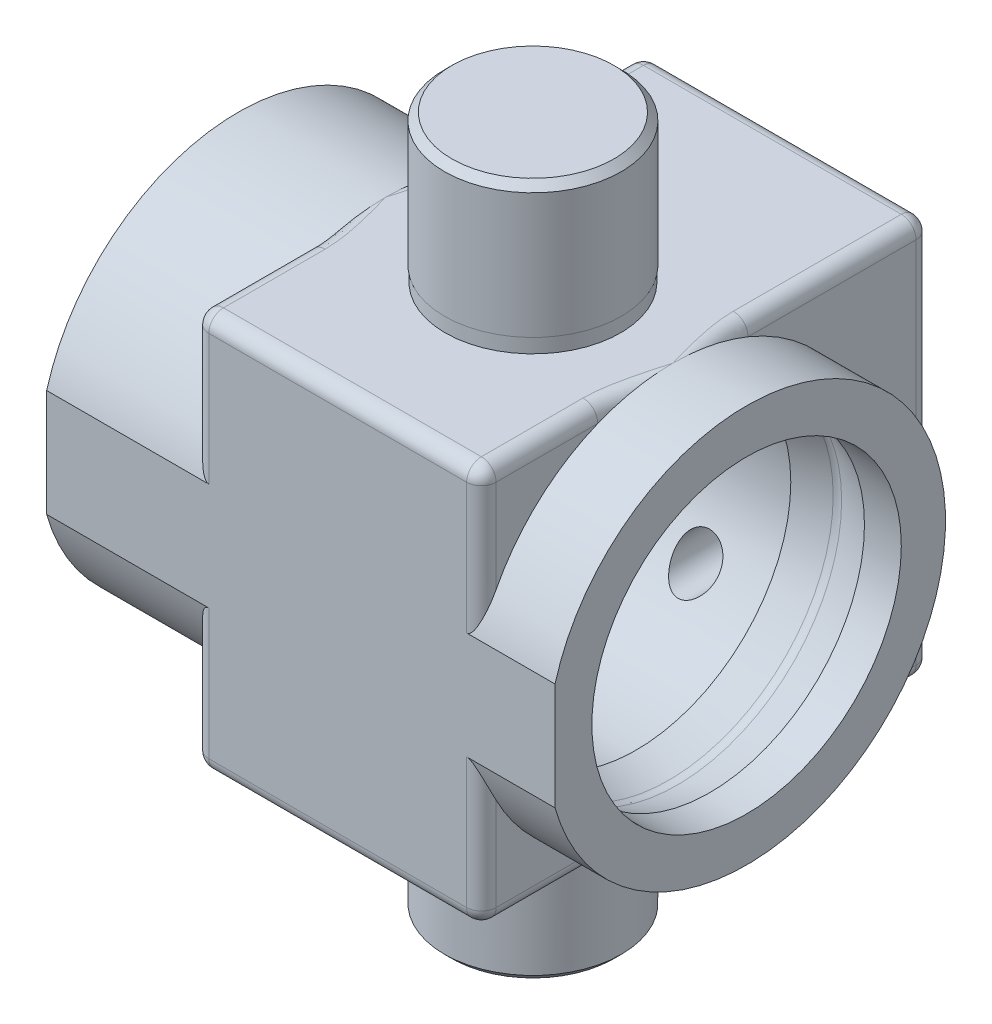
SolidWorks part; units mm, degrees
ref_plane "Plan1" through (0, 0, 0) normal (0, 0, 1) x (1, 0, 0)
ref_plane "Plan2" through (0, 0, 0) normal (0, 1, 0) x (1, 0, 0)
ref_plane "Plan3" through (0, 0, 0) normal (1, 0, 0) x (0, 0, -1)
sketch "Esquisse1" plane through (0, 0, 0) normal (0, 0, 1) x (1, 0, 0)
  line L1 (-40, -40) -> (29, -40)
  line L2 (-40, -40) -> (-40, 14)
  line L3 (-40, 14) -> (29, 14)
  line L4 (29, -40) -> (29, 14)
  dimension "D1" = 69
  dimension "D2" = 54
extrude "Base-Extrusion" add sketch "Esquisse1" along normal blind 61
sketch "Esquisse2" plane through (29, 0, 0) normal (1, 0, 0) x (0, 0, -1)
  line L0 (-35, 20) -> (-35, -50) construction
  line L1 (-61, -40) -> (-61, 14) construction
  line L2 (-70, -13) -> (10, -13) construction
  line L3 (-61, -40) -> (0, -40) construction
  circle A0 centre (-35, -13) radius 21
  dimension "D3" = 42
  dimension "D1" = 26
  dimension "D2" = 27
extrude "Enlèv. mat.-Extru.1" cut sketch "Esquisse2" against normal through all
ref_plane "Plan4" through (0, 0, 35) normal (0, 0, 1) x (1, 0, 0)
sketch "Esquisse6" plane through (0, 0, 35) normal (0, 0, 1) x (1, 0, 0)
  line L0 (65.5546, -13) -> (-67.3117, -13) construction
  line L1 (-40, -13) -> (29, -13) construction
  line L2 (-35, -13) -> (-25, -13)
  line L3 (-35, 8) -> (-35, -13)
  line L4 (14, -13) -> (24, -13)
  line L5 (-40, 14) -> (-40, -40) construction
  line L6 (-25, 8) -> (-25, -13)
  line L7 (24, 8) -> (24, -13)
  line L8 (29, -40) -> (29, 14) construction
  line L9 (14, 8) -> (14, -13)
  line L11 (-35, 8) -> (-30.6099, 9.2907)
  line L12 (-29.4923, 9.2938) -> (-25, 8)
  line L13 (14, 8) -> (18.4253, 9.3276)
  line L14 (19.5747, 9.3276) -> (24, 8)
  arc A0 (-29.4923, 9.2938) -> (-30.6099, 9.2907) centre (-30.0458, 7.3719) ccw
  arc A1 (19.5747, 9.3276) -> (18.4253, 9.3276) centre (19, 7.4119) ccw
  dimension "D1" = 2
  dimension "D2" = 5
  dimension "D3" = 10
  dimension "D4" = 5
  dimension "D5" = 10
revolve "Enlèvement de matière-Révolution1" cut sketch "Esquisse6" angle 360 about L0
sketch "Esquisse8" plane through (0, 0, 0) normal (1, 0, 0) x (0, 0, -1)
  line L0 (-35, 34) -> (-35, -60) construction
  line L1 (-47, 16) -> (-47, 34)
  line L2 (-61, 14) -> (0, 14) construction
  line L3 (-47, 34) -> (-35, 34)
  line L4 (-35, 14) -> (-35, 34)
  line L7 (-46.9, 16) -> (-46.9, 14)
  line L9 (-47, 16) -> (-46.9, 16)
  line L11 (-46.9, 14) -> (-35, 14)
  dimension "D3" = 12
  dimension "D4" = 11.9
  dimension "D5" = 2
revolve "Boss.-Révol.3" add sketch "Esquisse8" angle 360 about L0
sketch "Esquisse9" plane through (0, 0, 35) normal (0, 0, 1) x (1, 0, 0)
  line L0 (-11.9, -40) -> (-11.9, -42)
  line L1 (-40, -40) -> (29, -40) construction
  line L2 (-12, -42) -> (-11.9, -42)
  line L3 (0, 34) -> (0, -60) construction
  line L4 (-12, -42) -> (-12, -60)
  line L5 (-12, -60) -> (0, -60)
  line L6 (0, -29.72) -> (0, -73.63) construction
  line L7 (-11.9, -40) -> (0, -40)
  line L8 (0, -60) -> (0, -40)
  dimension "D1" = 11.9
  dimension "D2" = 2
  dimension "D3" = 12
  dimension "D4" = 20
revolve "Boss.-Révol.4" add sketch "Esquisse9" angle 360 about L6
sketch "Esquisse10" plane through (0, 0, 0) normal (0, 0, -1) x (-1, 0, 0)
  line L0 (-5, 28.59) -> (-5, -55.75) construction
  line L1 (-29, -40) -> (-29, 14) construction
  line L2 (-12.64, -1) -> (3.54, -1) construction
  line L3 (-11.25, -25) -> (0, -25) construction
  line L4 (25, -13) -> (-14, -13) construction
  circle A0 centre (-5, -1) radius 3
  circle A1 centre (-5, -25) radius 3
  dimension "D4" = 6
  dimension "D5" = 6
  dimension "D1" = 24
  dimension "D2" = 12
  dimension "D3" = 12
extrude "Enlèv. mat.-Extru.2" cut sketch "Esquisse10" against normal blind 22
chamfer "Chanfrein2" distance 1 angle 45 2 edges at (0, 34, 47) (0, -60, 47)
chamfer "Chanfrein3" distance 0.8 angle 45 2 edges at (2, -1, 0) (2, -25, 0)
sketch "Esquisse11" plane through (-40, 0, 0) normal (-1, 0, 0) x (0, 0, 1)
  line L1 (0, -40) -> (35, -40)
  line L2 (0, 14) -> (35, 14)
  line L3 (0, 14) -> (0, -40)
  line L4 (0, 14) -> (0, -40) construction
  line L5 (61, 14) -> (0, 14) construction
  line L6 (61, -40) -> (0, -40) construction
  arc A0 (35, 14) -> (35, -40) centre (35, -13) ccw
  circle A2 centre (35, -13) radius 22.2907 construction
extrude "Enlèv. mat.-Extru.3" cut sketch "Esquisse11" against normal blind 20
sketch "Esquisse12" plane through (-40, 0, 0) normal (-1, 0, 0) x (0, 0, 1)
  line L0 (35, 14) -> (61, 14)
  line L1 (35, -40) -> (61, -40)
  line L2 (61, 14) -> (61, -5.7199)
  line L3 (35, 14) -> (0, 14) construction
  line L4 (61, 14) -> (61, -40) construction
  line L5 (61, -40) -> (35, -40) construction
  line L6 (61, -20.2801) -> (61, -40)
  arc A0 (35, -40) -> (61, -20.2801) centre (35, -13) ccw
  arc A1 (35, 14) -> (35, -40) centre (35, -13) ccw construction
  arc A2 (61, -5.7199) -> (35, 14) centre (35, -13) ccw
extrude "Enlèv. mat.-Extru.4" cut sketch "Esquisse12" against normal blind 20
sketch "Esquisse13" plane through (29, 0, 0) normal (1, 0, 0) x (0, 0, -1)
  line L0 (-35, 14) -> (0, 14)
  line L1 (0, 14) -> (0, -40)
  line L2 (0, -40) -> (-35, -40)
  arc A0 (-35, -40) -> (-35, 14) centre (-35, -13) ccw
  arc A1 (-35, 14) -> (-61, -5.7199) centre (-35, -13) ccw construction
extrude "Enlèv. mat.-Extru.5" cut sketch "Esquisse13" against normal blind 10
sketch "Esquisse14" plane through (29, 0, 0) normal (1, 0, 0) x (0, 0, -1)
  line L0 (-35, 14) -> (-61, 14)
  line L1 (-61, 14) -> (-61, -5.7199)
  line L2 (-61, -40) -> (-35, -40)
  line L5 (-61, -40) -> (-61, 14) construction
  line L6 (-61, -40) -> (-35, -40) construction
  line L7 (-61, -20.2801) -> (-61, -40)
  arc A0 (-61, -20.2801) -> (-35, -40) centre (-35, -13) ccw
  arc A1 (-35, 14) -> (-61, -5.7199) centre (-35, -13) ccw
  arc A2 (-35, 14) -> (-61, -5.7199) centre (-35, -13) ccw construction
extrude "Enlèv. mat.-Extru.6" cut sketch "Esquisse14" against normal blind 10
fillet "Congé1" radius 2 18 edges at (19, 14, 17.5) (19, -13, 0) (19, -40, 17.5) (-0.5, 14, 61) (19, 4.1401, 61) (19, 14, 48) (19, -40, 48) (19, -30.1401, 61) (-0.5, -40, 0) (-20, -40, 17.5) (-20, -13, 0) (-20, 14, 17.5) (-0.5, -40, 61) (-20, -30.1401, 61) (-20, -40, 48) (-20, 14, 48) (-20, 4.1401, 61) (-0.5, 14, 0)
